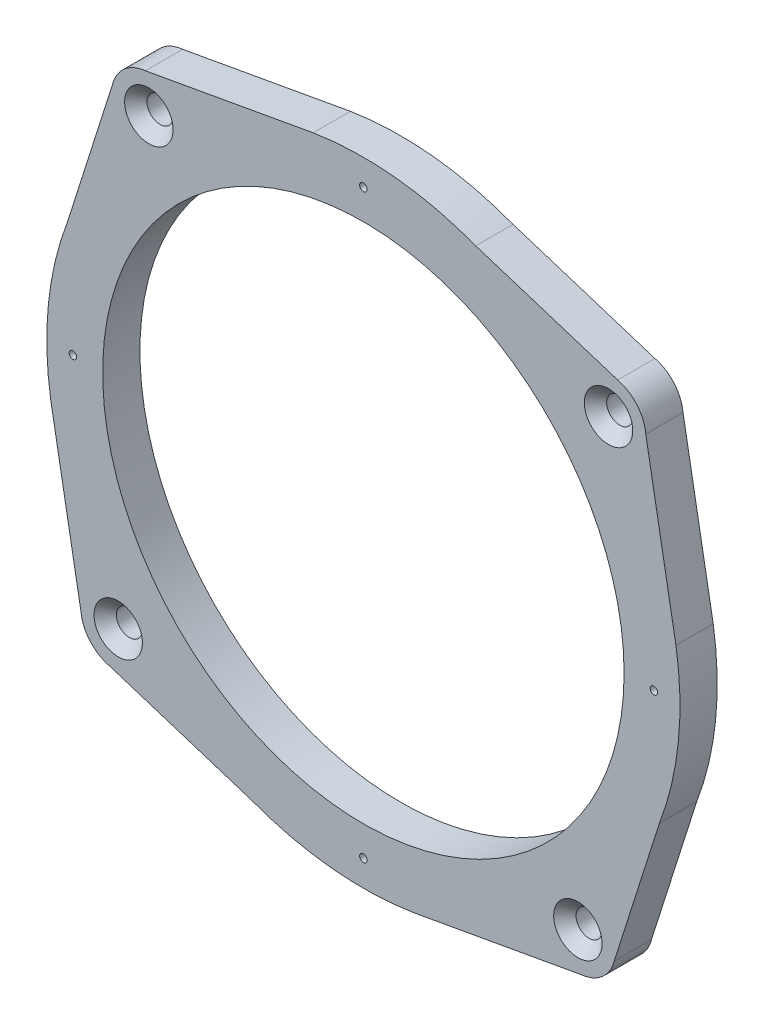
SolidWorks part; units mm, degrees
ref_plane "Спереди" through (0, 0, 0) normal (0, 0, 1) x (1, 0, 0)
ref_plane "Сверху" through (0, 0, 0) normal (0, 1, 0) x (1, 0, 0)
ref_plane "Справа" through (0, 0, 0) normal (1, 0, 0) x (0, 0, -1)
sketch "Эскиз1" plane through (0, 0, 0) normal (0, 0, 1) x (1, 0, 0)
  line L0 (58.2465, 772.6713) -> (57.4947, 747.6826) construction
  line L1 (-10.2804, 1901.0688) -> (14.6631, 1899.3891) construction
  line L2 (475.1958, 392.2729) -> (520.2533, 400.3738)
  line L3 (466.3984, 384.7323) -> (454.2727, 346.6293)
  line L4 (533.7346, 401.4497) -> (533.7346, 386.4497)
  line L5 (448.7346, 316.4497) -> (463.7346, 316.4497)
  line L6 (533.7346, 401.4497) -> (533.7346, 386.4497)
  line L7 (602.0172, 383.786) -> (563.9142, 395.9116)
  line L8 (609.5579, 374.9886) -> (617.6587, 329.931)
  line L9 (618.7346, 316.4497) -> (603.7346, 316.4497)
  line L10 (618.7346, 316.4497) -> (603.7346, 316.4497)
  line L11 (601.0709, 248.1671) -> (613.1965, 286.2701)
  line L12 (592.2735, 240.6265) -> (547.216, 232.5256)
  line L13 (533.7346, 231.4497) -> (533.7346, 246.4497)
  line L14 (533.7346, 231.4497) -> (533.7346, 246.4497)
  line L15 (465.452, 249.1134) -> (503.5551, 236.9878)
  line L16 (457.9114, 257.9108) -> (449.8105, 302.9684)
  line L17 (448.7346, 316.4497) -> (463.7346, 316.4497)
  arc A0 (533.7346, 386.4497) -> (463.7346, 316.4497) centre (533.7346, 316.4497) ccw
  arc A2 (454.2727, 346.6293) -> (448.7346, 316.4497) centre (533.7346, 316.4497) ccw
  arc A3 (475.1958, 392.2729) -> (466.3984, 384.7323) centre (476.1396, 382.2697) ccw
  circle A4 centre (476.1396, 382.2697) radius 3.5
  arc A5 (533.7346, 401.4497) -> (517.1394, 399.8139) centre (533.7346, 316.4497) ccw
  arc A6 (603.7346, 316.4497) -> (533.7346, 386.4497) centre (533.7346, 316.4497) ccw
  arc A7 (563.9142, 395.9116) -> (533.7346, 401.4497) centre (533.7346, 316.4497) ccw
  arc A8 (609.5579, 374.9886) -> (602.0172, 383.786) centre (599.5546, 374.0448) ccw
  arc A9 (618.7346, 316.4497) -> (617.0989, 333.045) centre (533.7346, 316.4497) ccw
  circle A10 centre (599.5546, 374.0448) radius 3.5
  arc A11 (533.7346, 246.4497) -> (603.7346, 316.4497) centre (533.7346, 316.4497) ccw
  arc A12 (613.1965, 286.2701) -> (618.7346, 316.4497) centre (533.7346, 316.4497) ccw
  arc A13 (592.2735, 240.6265) -> (601.0709, 248.1671) centre (591.3297, 250.6297) ccw
  arc A14 (533.7346, 231.4497) -> (550.3299, 233.0855) centre (533.7346, 316.4497) ccw
  circle A15 centre (591.3297, 250.6297) radius 3.5
  arc A16 (463.7346, 316.4497) -> (533.7346, 246.4497) centre (533.7346, 316.4497) ccw
  arc A17 (503.5551, 236.9878) -> (533.7346, 231.4497) centre (533.7346, 316.4497) ccw
  arc A18 (457.9114, 257.9108) -> (465.452, 249.1134) centre (467.9147, 258.8546) ccw
  arc A19 (448.7346, 316.4497) -> (450.3704, 299.8544) centre (533.7346, 316.4497) ccw
  circle A20 centre (467.9147, 258.8546) radius 3.5
  circle A21 centre (533.7346, 394.4497) radius 1
  circle A22 centre (611.7346, 316.4497) radius 1
  circle A23 centre (533.7346, 238.4497) radius 1
  circle A24 centre (455.7346, 316.4497) radius 1
  dimension "D3" = 4
  dimension "D4" = 70
  dimension "D5" = 85
  dimension "D6" = 15
  dimension "D8" = 2
  dimension "D9" = 4
  dimension "D1" = 25
  dimension "D2" = 25
  dimension "D7" = 8
extrude "Бобышка-Вытянуть1" add sketch "Эскиз1" along normal blind 10 contours L5 A19 L16 A18 L15 A17 L13 A16 A20 | L4 A5 L2 A3 L3 A2 L5 A0 A4 | L9 A9 L8 A8 L7 A7 L4 A6 A10 | L13 A14 L12 A13 L11 A12 L9 A11 A15
chamfer "Фаска1" distance 3 angle 45 4 edges at (594.8297, 250.6297, 10) (471.4147, 258.8546, 10) (603.0546, 374.0448, 10) (479.6396, 382.2697, 10)
